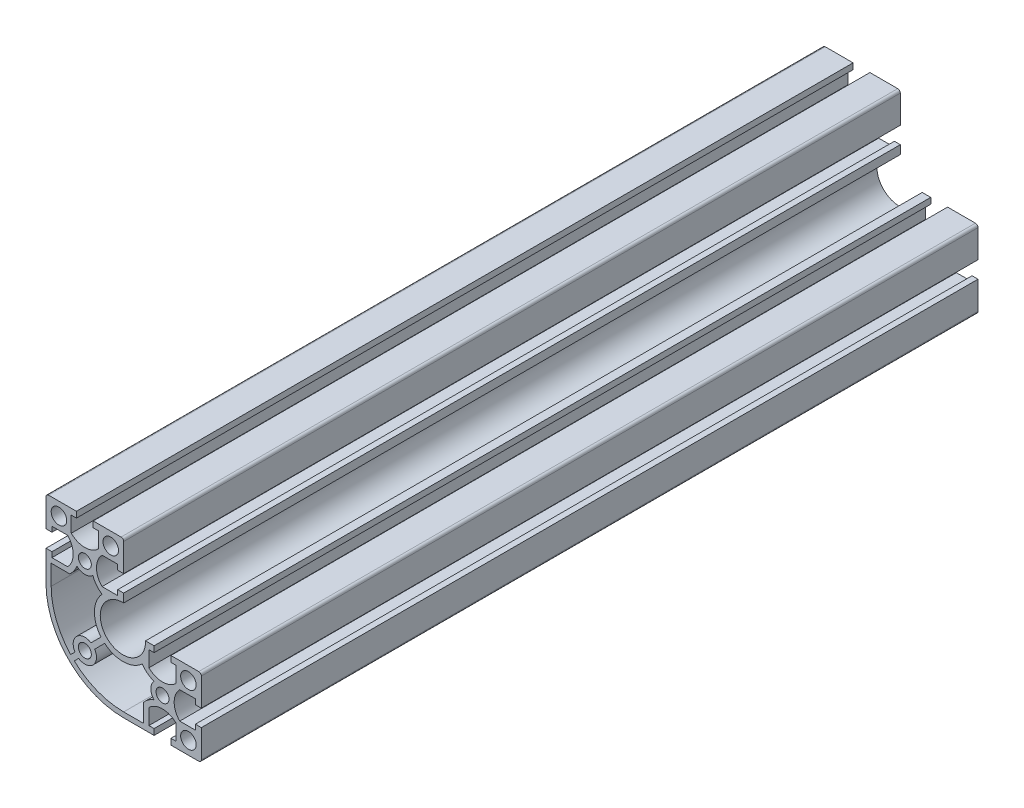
SolidWorks part; units mm, degrees
ref_plane "前视基准面" through (0, 0, 0) normal (0, 0, 1) x (1, 0, 0)
ref_plane "上视基准面" through (0, 0, 0) normal (0, 1, 0) x (1, 0, 0)
ref_plane "右视基准面" through (0, 0, 0) normal (1, 0, 0) x (0, 0, -1)
sketch "草图1" plane through (0, 0, 0) normal (0, 0, 1) x (1, 0, 0)
  line B0 (-18.5095, -17.0953) -> (-20.1935, -18.7793)
  line B1 (-27.7, 0.3) -> (-27.7, 8.05)
  line B2 (-27.7, 8.05) -> (-20.561, 8.05)
  line B3 (-8.4531, -7.0389) -> (-12.3047, -10.8905)
  line B4 (8.05, -20.561) -> (8.05, -27.7)
  line B5 (8.05, -27.7) -> (0.3, -27.7)
  line B6 (-18.7793, -20.1935) -> (-17.0953, -18.5095)
  line B7 (-10.8905, -12.3047) -> (-7.0389, -8.4531)
  line B8 (12.05, -2) -> (10.05, -2)
  line B9 (10.05, -2) -> (10.05, -8.0561)
  line B10 (20.55, -8.0561) -> (20.55, -2)
  line B11 (20.55, -2) -> (18.55, -2)
  line B12 (18.55, -2) -> (18.55, 0.3)
  line B13 (18.55, 0.3) -> (29.3, 0.3)
  line B14 (30.3, -0.7) -> (30.3, -11.45)
  line B15 (30.3, -11.45) -> (28, -11.45)
  line B16 (28, -11.45) -> (28, -9.45)
  line B17 (28, -9.45) -> (21.9439, -9.45)
  line B18 (21.9439, -19.95) -> (28, -19.95)
  line B19 (28, -19.95) -> (28, -17.95)
  line B20 (28, -17.95) -> (30.3, -17.95)
  line B21 (30.3, -17.95) -> (30.3, -28.7)
  line B22 (29.3, -29.7) -> (18.55, -29.7)
  line B23 (18.55, -29.7) -> (18.55, -27.4)
  line B24 (18.55, -27.4) -> (20.55, -27.4)
  line B25 (20.55, -27.4) -> (20.55, -21.3439)
  line B26 (10.05, -21.3439) -> (10.05, -27.4)
  line B27 (10.05, -27.4) -> (12.05, -27.4)
  line B28 (12.05, -27.4) -> (12.05, -29.7)
  line B29 (12.05, -29.7) -> (0.3, -29.7)
  line B30 (-29.7, 0.3) -> (-29.7, 12.05)
  line B31 (-29.7, 12.05) -> (-27.4, 12.05)
  line B32 (-27.4, 12.05) -> (-27.4, 10.05)
  line B33 (-27.4, 10.05) -> (-21.3439, 10.05)
  line B34 (-21.3439, 20.55) -> (-27.4, 20.55)
  line B35 (-27.4, 20.55) -> (-27.4, 18.55)
  line B36 (-27.4, 18.55) -> (-29.7, 18.55)
  line B37 (-29.7, 18.55) -> (-29.7, 29.3)
  line B38 (-28.7, 30.3) -> (-17.95, 30.3)
  line B39 (-17.95, 30.3) -> (-17.95, 28)
  line B40 (-17.95, 28) -> (-19.95, 28)
  line B41 (-19.95, 28) -> (-19.95, 21.9439)
  line B42 (-9.45, 21.9439) -> (-9.45, 28)
  line B43 (-9.45, 28) -> (-11.45, 28)
  line B44 (-11.45, 28) -> (-11.45, 30.3)
  line B45 (-11.45, 30.3) -> (-0.7, 30.3)
  line B46 (0.3, 29.3) -> (0.3, 18.55)
  line B47 (0.3, 18.55) -> (-2, 18.55)
  line B48 (-2, 18.55) -> (-2, 20.55)
  line B49 (-2, 20.55) -> (-8.0561, 20.55)
  line B50 (-8.0561, 10.05) -> (-2, 10.05)
  line B51 (-2, 10.05) -> (-2, 12.05)
  line B52 (-2, 12.05) -> (0.3, 12.05)
  line B53 (0.3, 12.05) -> (0.3, 8.7449)
  line B54 (8.7449, 0.3) -> (12.05, 0.3)
  line B55 (12.05, 0.3) -> (12.05, -2)
  circle B56 centre (-4.7, 25.3) radius 3
  circle B57 centre (-24.7, 25.3) radius 3
  circle B58 centre (-14.7, 15.3) radius 2.5
  circle B59 centre (-14.7, -14.7) radius 2.5
  arc B60 (-27.7, 0.3) -> (-20.1935, -18.7793) centre (0.3, 0.3) ccw
  arc B61 (-20.561, 8.05) -> (-17.7833, 12.0223) centre (-26.7, 15.3) ccw
  arc B62 (-17.7833, 12.0223) -> (-11.6167, 12.0223) centre (-14.7, 15.3) ccw
  arc B63 (-11.6167, 12.0223) -> (-8.0766, 7.4679) centre (-2.7, 15.3) ccw
  arc B64 (-8.0766, 7.4679) -> (-8.4531, -7.0389) centre (0, 0) ccw
  arc B65 (-12.3047, -10.8905) -> (-18.5095, -17.0953) centre (-14.7, -14.7) ccw
  arc B66 (12.0223, -17.7833) -> (8.05, -20.561) centre (15.3, -26.7) ccw
  arc B67 (-18.7793, -20.1935) -> (0.3, -27.7) centre (0.3, 0.3) ccw
  arc B68 (-17.0953, -18.5095) -> (-10.8905, -12.3047) centre (-14.7, -14.7) ccw
  arc B69 (-7.0389, -8.4531) -> (7.4679, -8.0766) centre (0, 0) ccw
  arc B70 (7.4679, -8.0766) -> (12.0223, -11.6167) centre (15.3, -2.7) ccw
  arc B71 (12.0223, -11.6167) -> (12.0223, -17.7833) centre (15.3, -14.7) ccw
  circle B72 centre (15.3, -14.7) radius 2.5
  circle B73 centre (25.3, -24.7) radius 3
  circle B74 centre (25.3, -4.7) radius 3
  arc B75 (10.05, -8.0561) -> (20.55, -8.0561) centre (15.3, -2.7) ccw
  arc B76 (30.3, -0.7) -> (29.3, 0.3) centre (29.3, -0.7) ccw
  arc B77 (21.9439, -9.45) -> (21.9439, -19.95) centre (27.3, -14.7) ccw
  arc B78 (29.3, -29.7) -> (30.3, -28.7) centre (29.3, -28.7) ccw
  arc B79 (20.55, -21.3439) -> (10.05, -21.3439) centre (15.3, -26.7) ccw
  arc B80 (-29.7, 0.3) -> (0.3, -29.7) centre (0.3, 0.3) ccw
  arc B81 (-21.3439, 10.05) -> (-21.3439, 20.55) centre (-26.7, 15.3) ccw
  arc B82 (-28.7, 30.3) -> (-29.7, 29.3) centre (-28.7, 29.3) ccw
  arc B83 (-19.95, 21.9439) -> (-9.45, 21.9439) centre (-14.7, 27.3) ccw
  arc B84 (0.3, 29.3) -> (-0.7, 30.3) centre (-0.7, 29.3) ccw
  arc B85 (-8.0561, 20.55) -> (-8.0561, 10.05) centre (-2.7, 15.3) ccw
  arc B86 (0.3, 8.7449) -> (8.7449, 0.3) centre (0, 0) ccw
sketch_block_instance "A$C6EC0244C-1"
sketch_block "A$C6EC0244C"
extrude "凸台-拉伸1" add sketch "草图1" along normal mid plane 300
